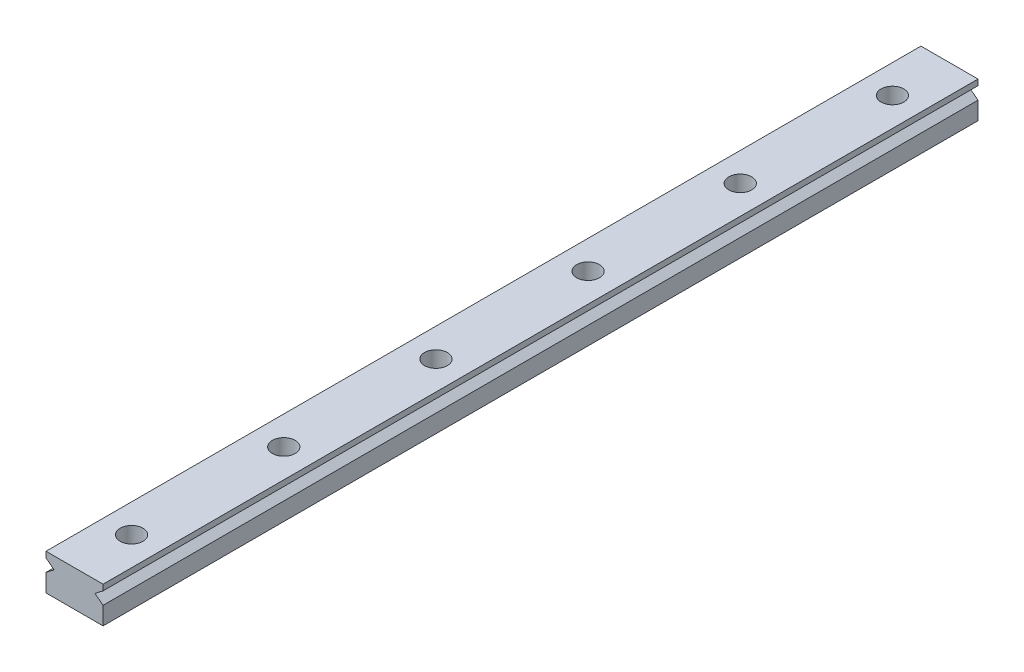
SolidWorks part; units mm, degrees
ref_plane "Front Plane" through (0, 0, 0) normal (0, 0, 1) x (1, 0, 0)
ref_plane "Top Plane" through (0, 0, 0) normal (0, 1, 0) x (1, 0, 0)
ref_plane "Right Plane" through (0, 0, 0) normal (1, 0, 0) x (0, 0, -1)
sketch "Sketch2" plane through (0, 0, 0) normal (0, 0, 1) x (1, 0, 0)
  line L0 (-7.5, 6.3333) -> (7.5, 6.3333) construction
  line L1 (-7.5, 0) -> (7.5, 0)
  line L2 (-7.5, 0) -> (-7.5, 4.6891)
  line L3 (-7.5, 9.5) -> (7.5, 9.5)
  line L4 (7.5, 0) -> (7.5, 4.6891)
  line L5 (7.5, 7.9776) -> (5.3571, 6.3333)
  line L6 (5.3571, 6.3333) -> (7.5, 4.6891)
  line L7 (7.5, 7.9776) -> (7.5, 9.5)
  line L8 (0, -0.548) -> (0, 6.6779) construction
  line L9 (-5.3571, 6.3333) -> (-7.5, 4.6891)
  line L10 (-7.5, 7.9776) -> (-5.3571, 6.3333)
  line L11 (-7.5, 7.9776) -> (-7.5, 9.5)
extrude "Rail" add sketch "Sketch2" against normal blind 230
ref_plane "Plane1_Assy" through (0, 0, -115) normal (0, 0, 1) x (1, 0, 0)
sketch "Sketch6" plane through (0, 0, 0) normal (1, 0, 0) x (0, 0, -1)
  line L0 (215, 8.9049) -> (215, -3.861) construction
  line L2 (215, 9.5) -> (218, 9.5)
  line L3 (218, 9.5) -> (218, 5)
  line L4 (218, 5) -> (216.75, 5)
  line L5 (216.75, 5) -> (216.75, 0)
  line L6 (216.75, 0) -> (215, 0)
  line L7 (230, 9.5) -> (0, 9.5) construction
  line L8 (230, 0) -> (0, 0) construction
  line L9 (215, 9.5) -> (215, 0)
  line L10 (230, 0) -> (230, 4.6891) construction
  dimension "Dimension [G]" = 6
  dimension "Dimension [d]" = 3.5
  dimension "Dimension [h]" = 4.5
  dimension "End Hole Spacing [N]" = 15
revolve "C'Bore" cut sketch "Sketch6" angle 360 about L0
pattern_linear "LPattern1" count 6 spacing 40 along (0, 0, 1) of "C'Bore"
equation "\"D4@Sketch2\"=\"Width [C]@Sketch2\"/7"
equation "\"D3@Sketch2\"=\"Height [H1]@Sketch2\"/3"
equation "\"D1@Plane1_Assy\" = \"Standard rail length [L]@Rail\"/2"
